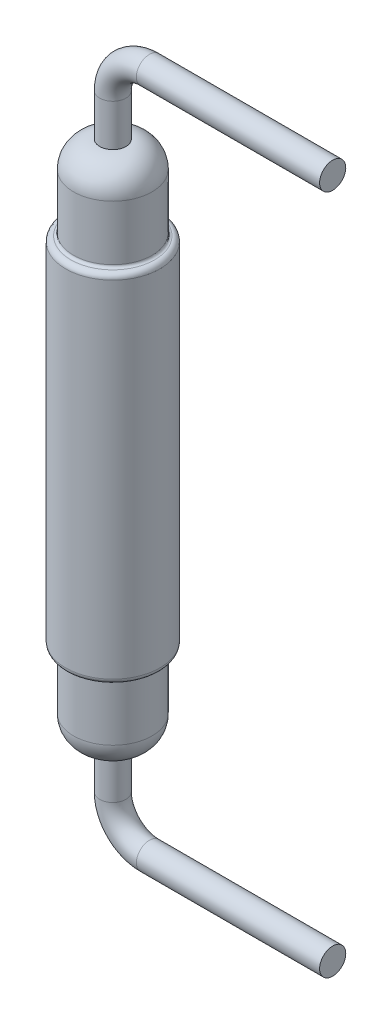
SolidWorks part; units mm, degrees
ref_plane "Front" through (0, 0, 0) normal (0, 0, 1) x (1, 0, 0)
ref_plane "Top" through (0, 0, 0) normal (0, 1, 0) x (1, 0, 0)
ref_plane "Right" through (0, 0, 0) normal (1, 0, 0) x (0, 0, -1)
sketch "Sketch1" plane through (0, 0, 0) normal (1, 0, 0) x (0, 0, -1)
  line L0 (0, 0) -> (0, 6.7792) construction
  line L1 (0.75, 4.5) -> (0.75, 3.45)
  line L2 (0, 0) -> (0.9, 0)
  line L3 (0, 0) -> (0, 5)
  line L4 (0, 5) -> (0.25, 5)
  line L5 (0.9, 0) -> (0.9, 3.4)
  line L6 (0.8, 3.4) -> (0.9, 3.4)
  arc A0 (0.8, 3.4) -> (0.75, 3.45) centre (0.8, 3.45) cw
  arc A1 (0.25, 5) -> (0.75, 4.5) centre (0.25, 4.5) cw
  dimension "D1" = 0.05
  dimension "D3" = 0.5
  dimension "D2" = 1.8
  dimension "D4" = 1.5
  dimension "D5" = 1.6
  dimension "D6" = 5
revolve "Revolve1" add sketch "Sketch1" angle 360 about L0
fillet "Fillet1" radius 0.1 1 edges at (0, 3.4, -0.9)
sketch "Sketch2" plane through (0, 0, 0) normal (0, 0, 1) x (1, 0, 0)
  line L0 (0, 5) -> (0, 5.8)
  line L1 (0.25, 5) -> (-0.25, 5) construction
  line L2 (0.7, 6.5) -> (4.2, 6.5)
  arc A0 (0.7, 6.5) -> (0, 5.8) centre (0.7, 5.8) ccw
  dimension "D1" = 0.7
  dimension "D2" = 6.5
  dimension "D3" = 4.2
sketch "Sketch3" plane through (0, 5, 0) normal (0, 1, 0) x (-1, 0, 0)
  circle A0 centre (0, 0) radius 0.25
  dimension "D1" = 0.5
sweep "Sweep1" add profiles "Sketch3" path "Sketch2"
mirror "Mirror1" about plane through (0, 0, 0) normal (0, -1, 0)
